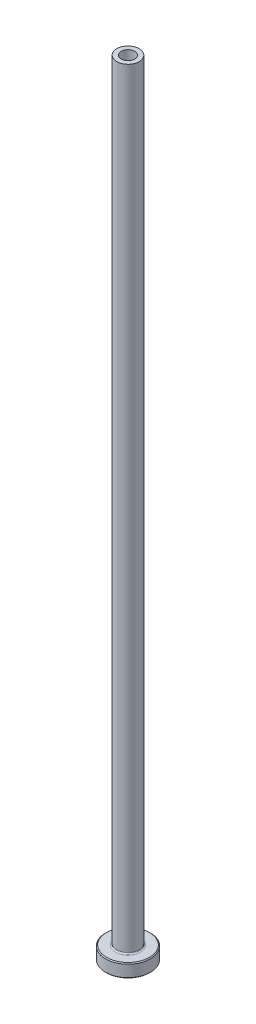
SolidWorks part; units mm, degrees
ref_plane "Front Plane" through (0, 0, 0) normal (0, 0, 1) x (1, 0, 0)
ref_plane "Top Plane" through (0, 0, 0) normal (0, 1, 0) x (1, 0, 0)
ref_plane "Right Plane" through (0, 0, 0) normal (1, 0, 0) x (0, 0, -1)
sketch "Sketch1" plane through (0, 0, 0) normal (0, 0, 1) x (1, 0, 0)
  line L0 (-1.5, 175) -> (-2.5, 175)
  line L1 (-2.5, 175) -> (-2.5, 3)
  line L2 (-2.5, 3) -> (-5, 3)
  line L3 (-5, 3) -> (-5, 0)
  line L4 (5.5, 0) -> (-5.5, 0) construction
  line L5 (-5, 0) -> (-1.75, 0)
  line L6 (-1.5, 130) -> (-1.5, 175)
  line L7 (0, 92.1877) -> (0, -15.5353) construction
  line L8 (0, -5.5) -> (0, 5.5) construction
  line L9 (-1.5, 130) -> (-1.75, 118)
  line L10 (-1.75, 118) -> (-1.75, 0)
  dimension "D1" = 0.25
  dimension "ID" = 3
  dimension "OD" = 5
  dimension "L" = 175
  dimension "H" = 10
  dimension "T" = 3
  dimension "N" = 45
  dimension "D2" = 12
revolve "Revolve1" add sketch "Sketch1" angle 360 about L7
fillet "Fillet1" radius 0.3 1 edges at (0, 3, 2.5)
chamfer "Chamfer1" distance 0.2 angle 45 2 edges at (0, 3, 5) (0, 0, 5)
chamfer "Chamfer3" distance 0.5 angle 45 1 edges at (0, 0, 1.75)
